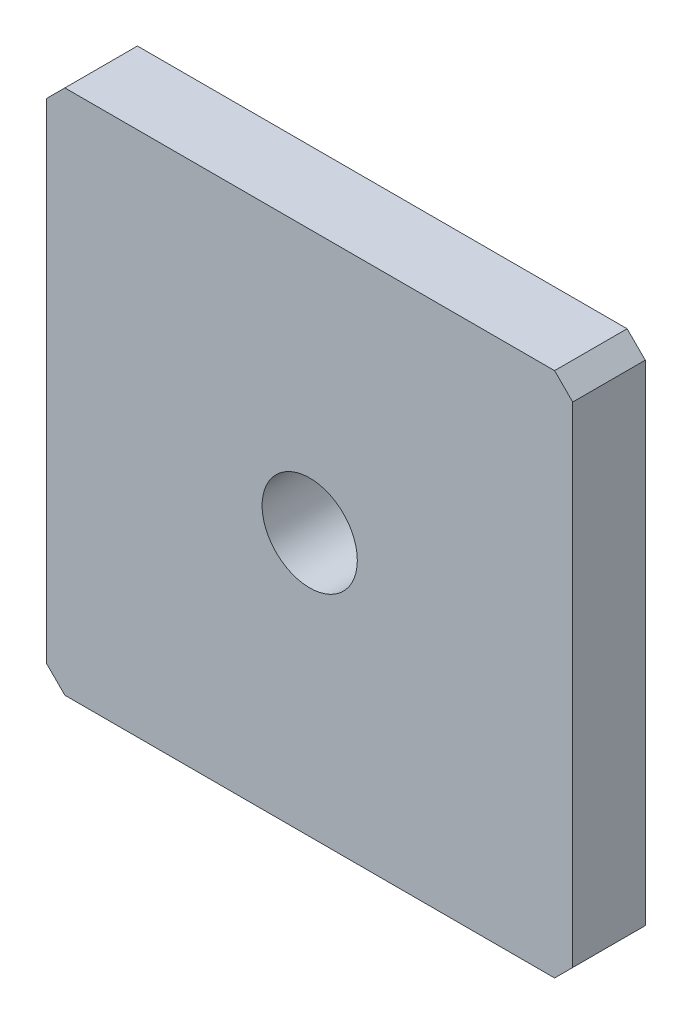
SolidWorks part; units mm, degrees
ref_plane "Plan de face" through (0, 0, 0) normal (0, 0, 1) x (1, 0, 0)
ref_plane "Plan de dessus" through (0, 0, 0) normal (0, 1, 0) x (1, 0, 0)
ref_plane "Plan de droite" through (0, 0, 0) normal (1, 0, 0) x (0, 0, -1)
sketch "Esquisse1" plane through (0, 0, 0) normal (0, 0, 1) x (1, 0, 0)
  line L1 (0, 0) -> (58, 0)
  line L2 (0, 0) -> (0, 58)
  line L3 (0, 58) -> (58, 58)
  line L4 (58, 0) -> (58, 58)
  dimension "D1" = 58
  dimension "D2" = 58
extrude "Extrusion1" add sketch "Esquisse1" along normal blind 8
hole_wizard "Diamètre du perçage Ø10.5 (10.5)1" positions "Esquisse3D1" profile "Esquisse3" hole size "Ø10.5" standard "DIN"
sketch3d "Esquisse3D1"
  line L0 (58, 58, 8) -> (0, 58, 8) construction
  line L1 (58, 0, 8) -> (58, 58, 8) construction
  point P0 (29, 29, 8)
  dimension "D1" = 29
  dimension "D2" = 29
sketch "Esquisse3" plane through (29, 29, 8) normal (1, 0, 0) x (0, -1, 0)
  line L0 (0, 0) -> (0, 8)
  line L1 (0, 8) -> (5.25, 8)
  line L2 (5.25, 8) -> (5.25, 0)
  line L5 (5.25, 0) -> (0, 0)
  line L11 (0, -6.35) -> (0, 107.95) construction
  dimension "Diamètre du perçage jusqu'au prochain" = 10.5
  dimension "Profondeur du perçage jusqu'au prochain" = 8
chamfer "Chanfrein1" distance 2 angle 45 4 edges at (0, 0, 4) (58, 0, 4) (58, 58, 4) (0, 58, 4)
